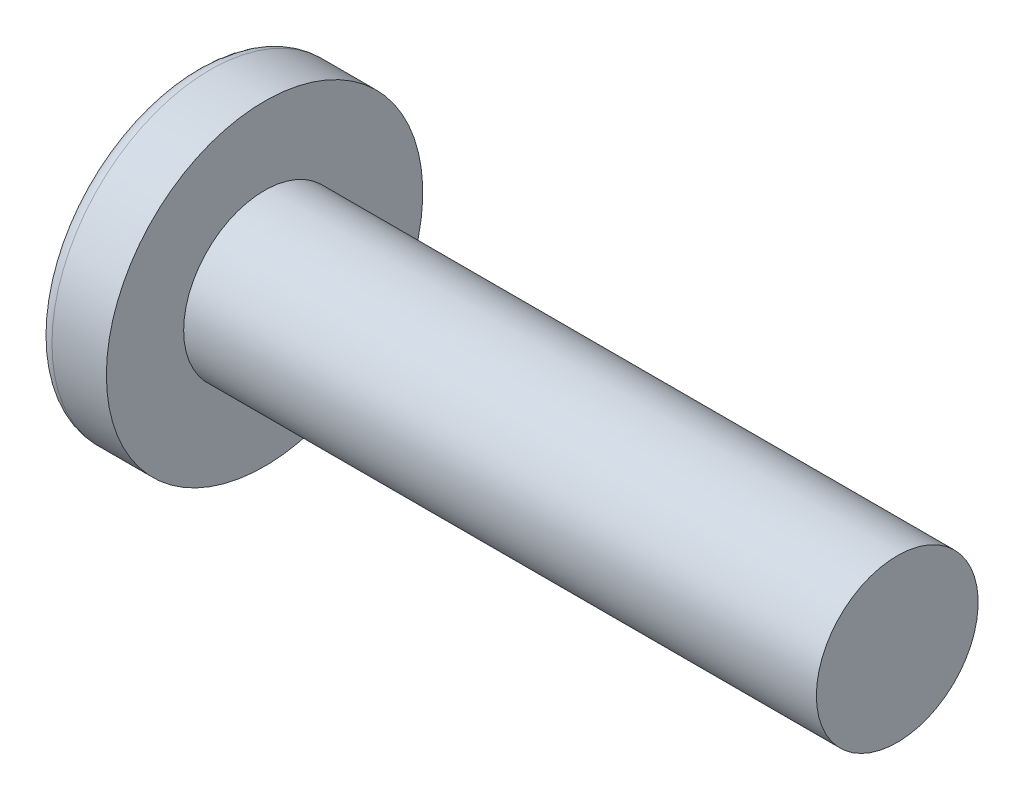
SolidWorks part; units mm, degrees
ref_plane "Plane1" through (0, 0, 0) normal (0, 0, 1) x (1, 0, 0)
ref_plane "Plane2" through (0, 0, 0) normal (0, 1, 0) x (1, 0, 0)
ref_plane "Plane3" through (0, 0, 0) normal (1, 0, 0) x (0, 0, -1)
sketch "BodySke" plane through (0, 0, 0) normal (0, 0, 1) x (1, 0, 0)
  line L0 (2.032, 1.4224) -> (2.032, 2.7813)
  line L1 (2.3495, 6.35) -> (2.3495, -3.175) construction
  line L2 (-25.4, 0) -> (127, 0) construction
  line L3 (13.1572, 0) -> (0, 0)
  line L4 (2.032, 1.4224) -> (13.1572, 1.4224)
  line L5 (13.1572, 1.4224) -> (13.1572, 0)
  line L6 (1.0756, 2.7813) -> (2.032, 2.7813)
  line L7 (2.032, -1.4224) -> (13.1572, -1.4224) construction
  line L8 (2.032, 6.35) -> (2.032, -3.175) construction
  arc A0 (0.8702, 2.6767) -> (0, 0) centre (4.5517, 0) ccw
  arc A2 (0.8702, 2.6767) -> (1.0756, 2.7813) centre (1.0756, 2.5273) cw
revolve "Base-Revolve" add sketch "BodySke" angle 360 about L2
sketch "Sketch3" plane through (0, 0, 0) normal (1, 0, 0) x (0, 0, -1)
  line L0 (0.4064, -1.8161) -> (-0.4064, -1.8161)
  line L1 (0.4064, -1.8161) -> (0.4064, 1.8161)
  line L2 (-0.4064, 1.8161) -> (0.4064, 1.8161)
  line L3 (-0.4064, 1.8161) -> (-0.4064, -1.8161)
ref_plane "Plane4" through (2.0066, 0, 0) normal (1, 0, 0) x (0, 0, -1)
sketch "Sketch4" plane through (2.0066, 0, 0) normal (1, 0, 0) x (0, 0, -1)
  line L0 (0.2032, -0.2032) -> (-0.2032, -0.2032)
  line L1 (0.2032, -0.2032) -> (0.2032, 0.2032)
  line L2 (-0.2032, 0.2032) -> (0.2032, 0.2032)
  line L3 (-0.2032, 0.2032) -> (-0.2032, -0.2032)
loft "Cut-Loft1" cut profiles "Sketch3", "Sketch4"
pattern_circular "CirPattern1" count 2 every 90 about axis through (0, 0, 0) along (1, 0, 0) of "Cut-Loft1"
sketch "ThdSchSke" plane through (0, 0, 0) normal (0, 0, 1) x (1, 0, 0)
  line L0 (2.667, -1.0439) -> (2.402, -1.4224)
  line L1 (2.667, -1.0439) -> (2.932, -1.4224)
  line L2 (2.932, -1.4224) -> (2.932, -1.778)
  line L3 (-3.175, 0) -> (5.1513, 0) construction
  line L5 (2.932, -1.778) -> (2.402, -1.778)
  line L6 (2.402, -1.778) -> (2.402, -1.4224)
equation "\"D1@Sketch3\" = \"Cross_dia@Sketch3\" / 2"
equation "\"D2@Sketch3\" = \"Cross_width@Sketch3\" / 2"
equation "\"D1@Sketch4\" = \"Cross_width@Sketch3\" *.5"
equation "\"D2@Sketch4\" = \"D1@Sketch4\""
equation "\"D3@Sketch4\" = \"D1@Sketch4\" / 2"
equation "\"D4@Sketch4\" = \"D2@Sketch4\" / 2"
equation "\"Thread_length@ThreadCosmetic\" = ((sgn( (\"Length@BodySke\" - \"Advance@BodySke\" ) - \"Thread_nom@BodySke\" )-1)*( (\"Length@BodySke\" - \"Advance@BodySke\" ) - \"Thread_nom@BodySke\" ))/-2+ \"Thread_nom@BodySke\""
equation "\"Thread_minor@ThdSchSke\" = \"Thread_minor@ThreadCosmetic\""
equation "\"Diameter@ThdSchSke\" = \"Diameter@BodySke\""
equation "\"Overcut@ThdSchSke\" = \"Diameter@BodySke\" * 1.25"
equation "\"Start@ThdSchSke\" = \"Head_ht@BodySke\" + \"Length@BodySke\" - \"Thread_length@ThreadCosmetic\"  '---Non-countersunk---"
equation "\"Num_threads@ThdSchPat\" = int( \"Thread_length@ThreadCosmetic\" / \"Advance@BodySke\" + 0.999 )  + 1"
equation "\"Advance@ThdSchPat\" = \"Thread_length@ThreadCosmetic\" /  (\"Num_threads@ThdSchPat\" - 1) 'relax it"
